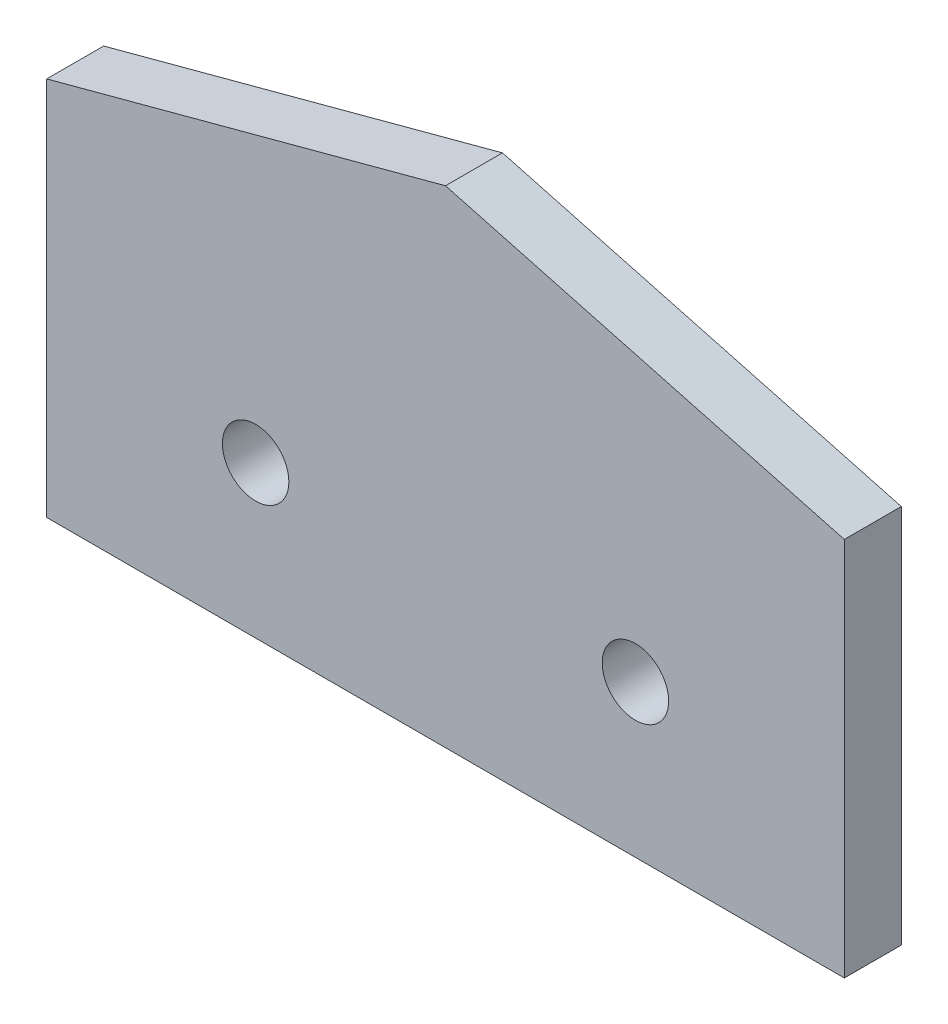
SolidWorks part; units mm, degrees
ref_plane "Front Plane" through (0, 0, 0) normal (0, 0, 1) x (1, 0, 0)
ref_plane "Top Plane" through (0, 0, 0) normal (0, 1, 0) x (1, 0, 0)
ref_plane "Right Plane" through (0, 0, 0) normal (1, 0, 0) x (0, 0, -1)
sketch "Sketch1" plane through (0, 0, 0) normal (0, 0, 1) x (1, 0, 0)
  line L0 (21, 0) -> (21, 25.6269) construction
  line L1 (0, 0) -> (42, 0)
  line L2 (0, 0) -> (0, 20)
  line L3 (0, 8) -> (42, 8) construction
  line L4 (42, 0) -> (42, 20)
  line L5 (0, 20) -> (21, 25.6269)
  line L6 (21, 25.6269) -> (42, 20)
  circle A0 centre (11, 8) radius 1.75
  circle A1 centre (31, 8) radius 1.75
  dimension "D2" = 3.5
  dimension "D3" = 11
  dimension "D4" = 20
  dimension "D1" = 8
  dimension "D5" = 42
  dimension "D6" = 150
  dimension "D7" = 20
  dimension "D8" = 20
extrude "Extrude1" add sketch "Sketch1" along normal blind 3
